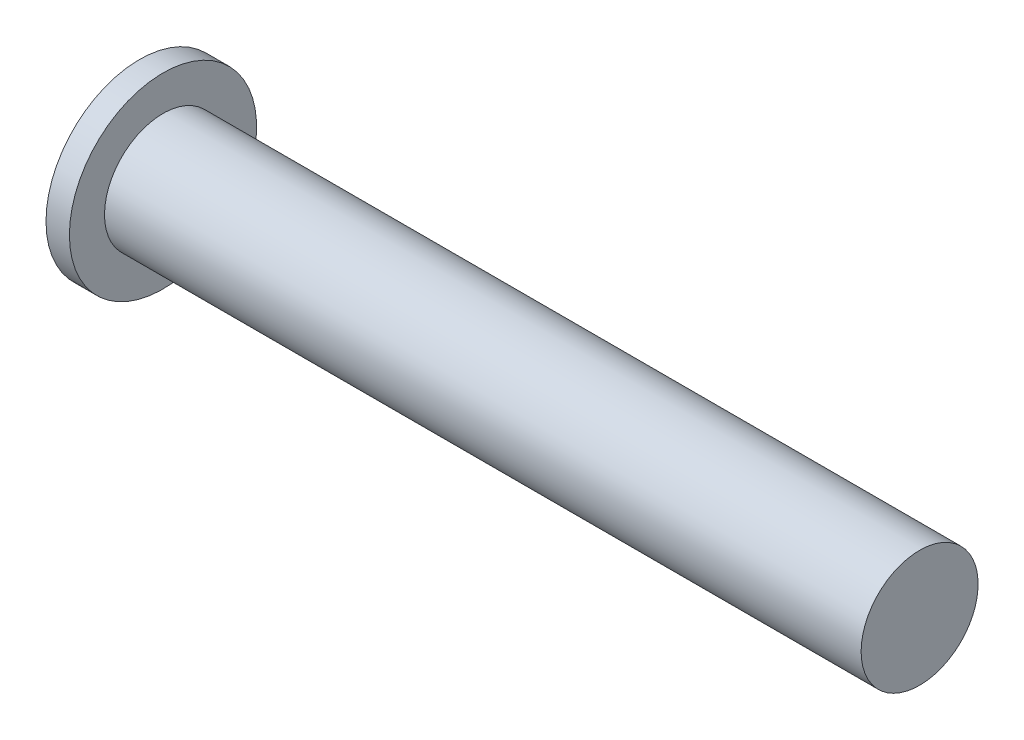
SolidWorks part; units mm, degrees
ref_plane "Front Plane" through (0, 0, 0) normal (0, 0, 1) x (1, 0, 0)
ref_plane "Top Plane" through (0, 0, 0) normal (0, 1, 0) x (1, 0, 0)
ref_plane "Right Plane" through (0, 0, 0) normal (1, 0, 0) x (0, 0, -1)
sketch "Sketch1" plane through (0, 0, 0) normal (0, 0, 1) x (1, 0, 0)
  line L0 (0, 0) -> (0, 4.8768)
  line L1 (0, 4.8768) -> (1.2192, 4.8768)
  line L2 (1.2192, 4.8768) -> (1.2192, 3.048)
  line L3 (1.2192, 3.048) -> (40.64, 3.048)
  line L4 (40.64, 3.048) -> (40.64, 0)
  line L5 (40.64, 0) -> (0, 0)
  line L6 (40.64, 0) -> (0, 0) construction
revolve "Revolve1" add sketch "Sketch1" angle 360 about L6
ref_plane "Plane1" through (40.64, 0, 0) normal (1, 0, 0) x (0, 0, -1)
